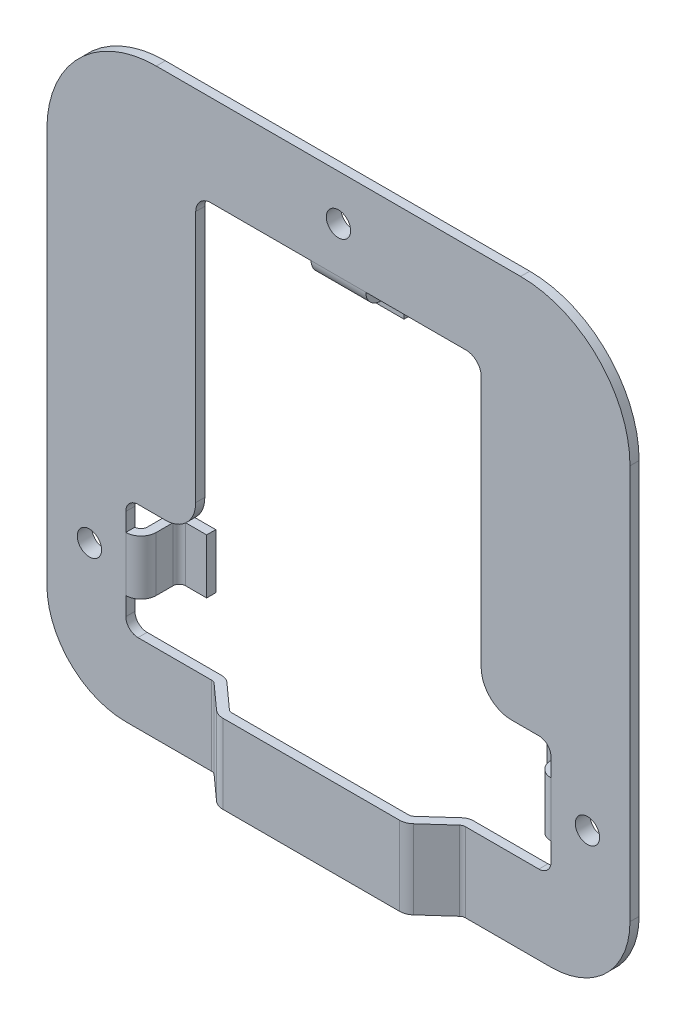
SolidWorks part; units mm, degrees
ref_plane "Спереди" through (0, 0, 0) normal (0, 0, 1) x (1, 0, 0)
ref_plane "Сверху" through (0, 0, 0) normal (0, 1, 0) x (1, 0, 0)
ref_plane "Справа" through (0, 0, 0) normal (1, 0, 0) x (0, 0, -1)
sketch "Эскиз1" plane through (0, 0, 0) normal (0, 0, 1) x (1, 0, 0)
  line L1 (13, 0) -> (83, 0)
  line L2 (0, 13) -> (0, 78)
  line L3 (18, 96) -> (78, 96)
  line L4 (96, 13) -> (96, 78)
  arc A0 (96, 13) -> (83, 0) centre (83, 13) cw
  arc A1 (0, 13) -> (13, 0) centre (13, 13) ccw
  arc A2 (96, 78) -> (78, 96) centre (78, 78) ccw
  arc A3 (18, 96) -> (0, 78) centre (18, 78) ccw
  point P9 (0, 0)
  dimension "D1" = 13
  dimension "D2" = 18
  dimension "D3" = 96
  dimension "D4" = 96
extrude "Бобышка-Вытянуть1" add sketch "Эскиз1" against normal blind 1.5
sketch "Эскиз2" plane through (0, 0, 0) normal (0, 0, 1) x (1, 0, 0)
  line L0 (48, 96) -> (48, 0) construction
  line L1 (78, 96) -> (18, 96) construction
  line L2 (13, 0) -> (83, 0) construction
  line L3 (27, 81) -> (69, 81)
  line L4 (71.5, 78.5) -> (71.5, 37)
  line L5 (15, 13) -> (27.5, 13)
  line L6 (83, 15) -> (83, 30)
  line L7 (81, 32) -> (76.5, 32)
  line L8 (15, 32) -> (19.5, 32)
  line L9 (13, 15) -> (13, 30)
  line L10 (24.5, 78.5) -> (24.5, 37)
  line L11 (48, 0) -> (68.5, 0)
  line L12 (68.5, 0) -> (68.5, 13)
  line L13 (48, 0) -> (27.5, 0)
  line L14 (27.5, 0) -> (27.5, 13)
  line L15 (68.5, 13) -> (81, 13)
  line L16 (7, 22.5) -> (89, 22.5) construction
  arc A0 (81, 13) -> (83, 15) centre (81, 15) ccw
  arc A1 (83, 30) -> (81, 32) centre (81, 30) ccw
  arc A2 (71.5, 78.5) -> (69, 81) centre (69, 78.5) ccw
  arc A3 (76.5, 32) -> (71.5, 37) centre (76.5, 37) cw
  arc A4 (19.5, 32) -> (24.5, 37) centre (19.5, 37) ccw
  arc A5 (24.5, 78.5) -> (27, 81) centre (27, 78.5) cw
  arc A6 (13, 30) -> (15, 32) centre (15, 30) cw
  arc A7 (15, 13) -> (13, 15) centre (15, 15) cw
  circle A8 centre (48, 88.5) radius 2
  circle A9 centre (89, 22.5) radius 2
  circle A10 centre (7, 22.5) radius 2
  point P6 (24.5, 81)
  point P9 (48, 81)
  point P14 (83, 13)
  point P17 (83, 32)
  point P20 (71.5, 81)
  point P35 (48, 13)
  point P36 (13, 32)
  point P37 (13, 13)
  dimension "D6" = 2
  dimension "D7" = 2.5
  dimension "D8" = 5
  dimension "D11" = 41
  dimension "D1" = 68
  dimension "D2" = 19
  dimension "D3" = 35
  dimension "D4" = 23.5
  dimension "D5" = 15
  dimension "D9" = 20.5
  dimension "D10" = 20.5
  dimension "D12" = 41
  dimension "D13" = 66
  dimension "D14" = 7.5
extrude "Вырез-Вытянуть1" cut sketch "Эскиз2" against normal blind 2
sketch "Эскиз3" plane through (0, 0, 0) normal (0, -1, 0) x (1, 0, 0)
  line L0 (63.2096, 2.7433) -> (67.9244, -1.5)
  line L1 (62.5407, 3) -> (33.4593, 3)
  line L2 (62.5407, 4.5) -> (33.4593, 4.5)
  line L3 (32.7904, 2.7433) -> (28.0756, -1.5)
  line L4 (31.7869, 3.8582) -> (27.5, 0)
  line L5 (27.5, 0) -> (27.5, -1.5)
  line L6 (64.2131, 3.8582) -> (68.5, 0)
  line L7 (63.2096, 2.7433) -> (67.4966, -1.1149) construction
  line L8 (32.7904, 2.7433) -> (28.5034, -1.1149) construction
  line L9 (27.5, -1.5) -> (28.0756, -1.5)
  line L10 (67.9244, -1.5) -> (68.5, -1.5)
  line L11 (68.5, -1.5) -> (68.5, 0)
  arc A0 (31.7869, 3.8582) -> (33.4593, 4.5) centre (33.4593, 2) cw
  arc A1 (64.2131, 3.8582) -> (62.5407, 4.5) centre (62.5407, 2) ccw
  arc A2 (63.2096, 2.7433) -> (62.5407, 3) centre (62.5407, 2) ccw
  arc A3 (32.7904, 2.7433) -> (33.4593, 3) centre (33.4593, 2) cw
  dimension "D1" = 2.5
  dimension "D2" = 2.5
  dimension "D3" = 1.5
extrude "Бобышка-Вытянуть2" add sketch "Эскиз3" against normal up to surface (13 mm away)
fillet "Скругление1" radius 2 2 edges at (28.0756, 6.5, -1.5) (67.9244, 6.5, -1.5)
fillet "Скругление2" radius 1 2 edges at (27.5, 6.5, 0) (68.5, 6.5, 0)
sketch "Эскиз4" plane through (0, 0, 0) normal (0, 0, 1) x (1, 0, 0)
  line L0 (83, 22.5) -> (13, 22.5) construction
  line L1 (83, 15) -> (83, 30) construction
  line L2 (13, 30) -> (13, 15) construction
  line L3 (48, 96) -> (48, 0) construction
  line L4 (78, 96) -> (18, 96) construction
  line L5 (62.5407, 0) -> (33.4593, 0) construction
  line L6 (48, 96) -> (48, 81) construction
  line L7 (69, 81) -> (27, 81) construction
ref_plane "Плоскость1" through (0, 22.5, 0) normal (0, 1, 0) x (-1, 0, 0)
sketch "Эскиз5" plane through (0, 22.5, 0) normal (0, 1, 0) x (-1, 0, 0)
  line L2 (-83, -1.5) -> (-82, -1.5)
  line L4 (-80.5, 0) -> (-80.5, -5.3)
  line L5 (-79.5, -7.8) -> (-76, -7.8)
  line L6 (-82, -1.5) -> (-82, -5.3)
  line L8 (-79.5, -6.3) -> (-76, -6.3)
  line L9 (-76, -6.3) -> (-76, -7.8)
  line L10 (-80.5, 0) -> (-83, 0)
  line L11 (-82, 0) -> (-82, -5.3) construction
  line L12 (-83, 0) -> (-83, -1.5)
  line L13 (-48, 4.5) -> (-48, -1.5) construction
  line L14 (-62.5407, 4.5) -> (-33.4593, 4.5) construction
  line L15 (-27, -1.5) -> (-69, -1.5) construction
  line L16 (-13, 0) -> (-13, -1.5)
  line L17 (-15.5, 0) -> (-13, 0)
  line L18 (-20, -6.3) -> (-20, -7.8)
  line L19 (-16.5, -6.3) -> (-20, -6.3)
  line L20 (-14, -1.5) -> (-14, -5.3)
  line L21 (-16.5, -7.8) -> (-20, -7.8)
  line L22 (-15.5, 0) -> (-15.5, -5.3)
  line L23 (-13, -1.5) -> (-14, -1.5)
  arc A0 (-79.5, -7.8) -> (-82, -5.3) centre (-79.5, -5.3) cw
  arc A1 (-79.5, -6.3) -> (-80.5, -5.3) centre (-79.5, -5.3) cw
  arc A2 (-16.5, -6.3) -> (-15.5, -5.3) centre (-16.5, -5.3) ccw
  arc A3 (-16.5, -7.8) -> (-14, -5.3) centre (-16.5, -5.3) ccw
  dimension "D2" = 2.5
  dimension "D3" = 1.5
extrude "Бобышка-Вытянуть3" add sketch "Эскиз5" along normal blind 4.5 and the other way blind 4.5
ref_plane "Плоскость2" through (48, 0, 0) normal (-1, 0, 0) x (0, -1, 0)
sketch "Эскиз7" plane through (48, 0, 0) normal (-1, 0, 0) x (0, -1, 0)
  line L0 (-81, -1.5) -> (-80, -1.5)
  line L1 (-78.5, 0) -> (-78.5, -5.3)
  line L2 (-77.5, -7.8) -> (-74, -7.8)
  line L3 (-80, -1.5) -> (-80, -5.3)
  line L4 (-77.5, -6.3) -> (-74, -6.3)
  line L5 (-74, -6.3) -> (-74, -7.8)
  line L6 (-78.5, 0) -> (-81, 0)
  line L7 (-81, 0) -> (-81, -1.5)
  line L8 (-81, 0) -> (-81, 0.157) construction
  arc A0 (-77.5, -7.8) -> (-80, -5.3) centre (-77.5, -5.3) cw
  arc A1 (-77.5, -6.3) -> (-78.5, -5.3) centre (-77.5, -5.3) cw
  dimension "D1" = 2.5
extrude "Бобышка-Вытянуть4" add sketch "Эскиз7" along normal blind 4.5 and the other way blind 4.5
fillet "Скругление3" radius 2.5 3 edges at (15.5, 22.5, 0) (80.5, 22.5, 0) (48, 78.5, 0)
fillet "Скругление4" radius 1 3 edges at (14, 22.5, -1.5) (82, 22.5, -1.5) (48, 80, -1.5)
sketch "Эскиз8" plane through (0, 0, -1.5) normal (0, 0, -1) x (-1, 0, 0)
  circle A0 centre (-48, 88.5) radius 2
  circle A1 centre (-48, 88.5) radius 2.6
  circle A2 centre (-7, 22.5) radius 2.6
  circle A3 centre (-7, 22.5) radius 2
  circle A4 centre (-89, 22.5) radius 2
  circle A5 centre (-89, 22.5) radius 2.6
extrude "Бобышка-Вытянуть5" add sketch "Эскиз8" along normal blind 0.9
